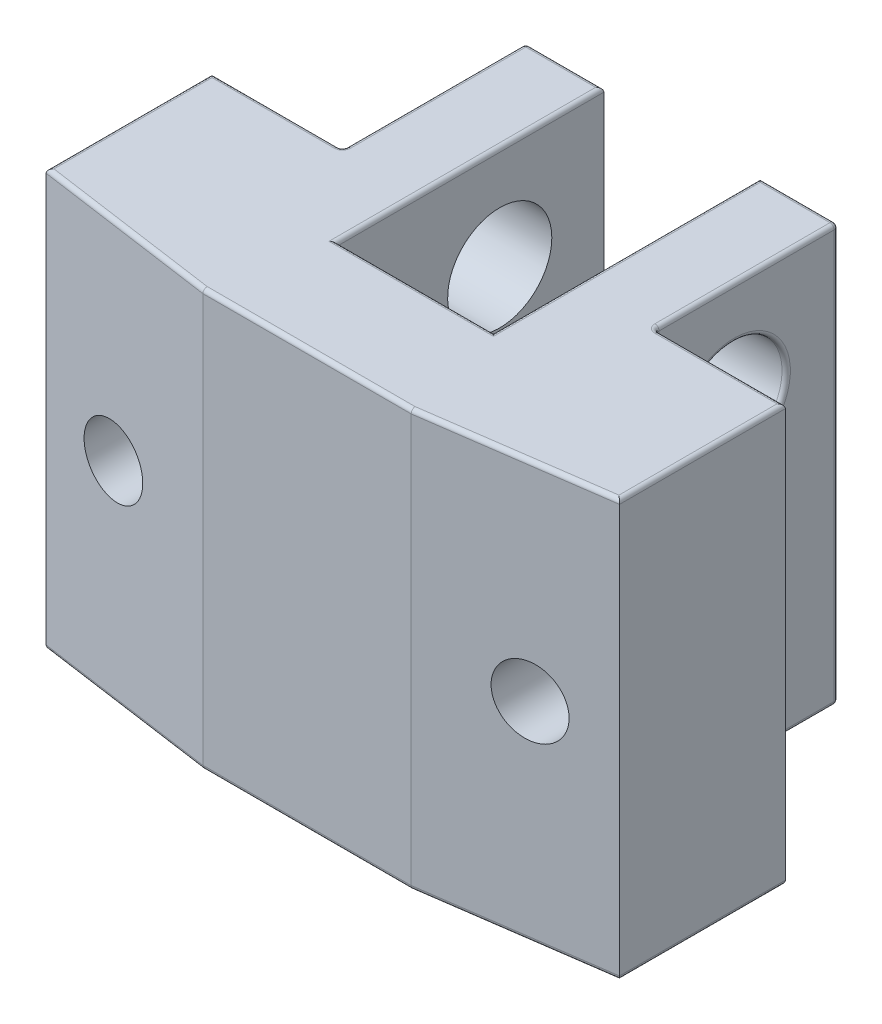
SolidWorks part; units mm, degrees
ref_plane "FRONT" through (0, 0, 0) normal (0, 0, 1) x (1, 0, 0)
ref_plane "TOP" through (0, 0, 0) normal (0, 1, 0) x (1, 0, 0)
ref_plane "RIGHT SIDE" through (0, 0, 0) normal (1, 0, 0) x (0, 0, -1)
sketch "Sketch1" plane through (0, 0, 0) normal (0, 0, 1) x (1, 0, 0)
  line L0 (0, 76.2) -> (0, -78.74) construction
  line L1 (17.4752, 6.35) -> (-17.4752, 6.35)
  line L2 (-17.4752, 6.35) -> (-17.4752, -19.05)
  line L3 (-17.4752, -19.05) -> (17.4752, -19.05)
  line L4 (17.4752, 6.35) -> (17.4752, -19.05)
  line L5 (38.1, 0) -> (-33.02, 0) construction
  point P7 (-15.875, 0)
  point P8 (0, 0)
  point P13 (0, -6.35)
  point P14 (0, 6.35)
  dimension "D1" = 17.4752
  dimension "D2" = 6.35
  dimension "D3" = 17.4752
  dimension "D4" = 25.4
extrude "Base-Extrude" add sketch "Sketch1" along normal blind 22.86
sketch "Sketch3" plane through (0, 0, 22.86) normal (0, 0, -1) x (-1, 0, 0)
  line L0 (0, 30.48) -> (0, -15.24) construction
  line L1 (-17.4752, 6.35) -> (17.4752, 6.35) construction
  circle A0 centre (12.7, -6.35) radius 2.0828
  circle A1 centre (-12.7, -6.35) radius 2.0828
  dimension "D1" = 4.1656
  dimension "D3" = 12.7
  dimension "D2" = 25.4
extrude "#8-32" cut sketch "Sketch3" along normal blind 12.7
sketch "Sketch5" plane through (-17.4752, 0, 0) normal (-1, 0, 0) x (0, 0, 1)
  line L0 (22.86, 6.35) -> (0, 6.35) construction
  line L1 (0, 6.35) -> (0, -19.05) construction
  circle A0 centre (6.35, 0) radius 3.175
  dimension "D1" = 6.35
  dimension "D2" = 6.35
  dimension "D3" = 6.35
extrude "Cut-Extrude1" cut sketch "Sketch5" against normal through all
sketch "Sketch6" plane through (0, 0, 0) normal (0, 0, 1) x (1, 0, 0)
  line L0 (-4.7625, -5.2832) -> (-4.7625, 6.35)
  line L1 (17.4752, 6.35) -> (-17.4752, 6.35) construction
  line L2 (-4.7625, 6.35) -> (4.7625, 6.35)
  line L3 (4.7625, -5.2832) -> (4.7625, 6.35)
  arc A0 (-4.7625, -5.2832) -> (4.7625, -5.2832) centre (0, -5.2832) ccw
  dimension "D1" = 5.2832
  dimension "D3" = 4.7625
  dimension "D2" = 4.7625
extrude "Cut-Extrude2" cut sketch "Sketch6" along normal blind 16.256
sketch "Sketch7" plane through (0, 6.35, 0) normal (0, 1, 0) x (-1, 0, 0)
  line L0 (0, 16.256) -> (0, 0) construction
  line L1 (-17.4752, 22.86) -> (-17.4752, 0) construction
  line L2 (-17.4752, 22.86) -> (17.4752, 22.86) construction
  line L3 (-17.4752, 21.2852) -> (-6.35, 22.86)
  line L5 (-6.35, 22.86) -> (-17.4752, 22.86)
  line L6 (-17.4752, 22.86) -> (-17.4752, 21.2852)
  line L7 (0, 15.875) -> (0, 33.0288) construction
  line L8 (17.4752, 22.86) -> (17.4752, 21.2852)
  line L9 (6.35, 22.86) -> (17.4752, 22.86)
  line L10 (17.4752, 21.2852) -> (6.35, 22.86)
  dimension "D1" = 1.5748
  dimension "D3" = 6.35
extrude "Cut-Extrude3" cut sketch "Sketch7" against normal through all
sketch "Sketch8" plane through (0, -19.05, 0) normal (0, -1, 0) x (1, 0, 0)
  line L0 (17.4752, 11.176) -> (9.525, 11.176)
  line L2 (17.4752, 21.2852) -> (17.4752, 0) construction
  line L3 (17.4752, 0) -> (9.525, 0)
  line L4 (-17.4752, 0) -> (17.4752, 0) construction
  line L5 (9.525, 0) -> (9.525, 11.176)
  line L6 (0, 0) -> (0, -6.8958) construction
  line L7 (0, 16.256) -> (0, 0) construction
  line L8 (-17.4752, 11.176) -> (-17.4752, 0)
  line L9 (-9.525, 0) -> (-9.525, 11.176)
  line L10 (-17.4752, 0) -> (-9.525, 0)
  line L11 (-17.4752, 11.176) -> (-9.525, 11.176)
  line L13 (17.4752, 11.176) -> (17.4752, 0)
  dimension "D1" = 9.525
  dimension "D2" = 11.176
extrude "Cut-Extrude4" cut sketch "Sketch8" against normal through all
fillet "Fillet1" radius 0.254
